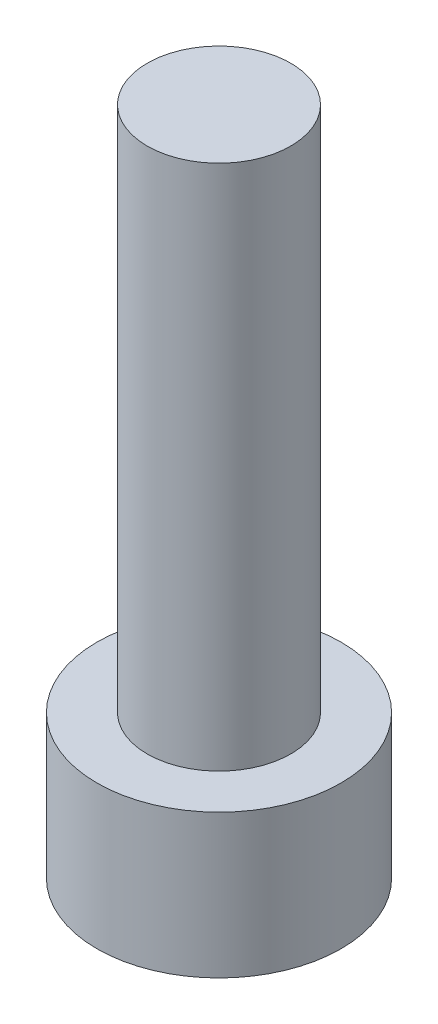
SolidWorks part; units mm, degrees
ref_plane "前视基准面" through (0, 0, 0) normal (0, 0, 1) x (1, 0, 0)
ref_plane "上视基准面" through (0, 0, 0) normal (0, 1, 0) x (1, 0, 0)
ref_plane "右视基准面" through (0, 0, 0) normal (1, 0, 0) x (0, 0, -1)
other "Configuration Table"
sketch "草图1" plane through (0, 0, 0) normal (0, 1, 0) x (1, 0, 0)
  circle A0 centre (0, 0) radius 5.1
  dimension "D1" = 10.2
extrude "凸台-拉伸1" add sketch "草图1" along normal blind 6
sketch "草图2" plane through (0, 6, 0) normal (0, 1, 0) x (1, 0, 0)
  circle A0 centre (0, 0) radius 3
  dimension "D1" = 6
extrude "凸台-拉伸2" add sketch "草图2" along normal blind 22
sketch "草图3" plane through (0, 0, 0) normal (0, -1, 0) x (1, 0, 0)
  line L1 (2.3571, -1.6665) -> (2.6218, 1.2081)
  line L2 (2.6218, 1.2081) -> (0.2647, 2.8746)
  line L3 (0.2647, 2.8746) -> (-2.3571, 1.6665)
  line L4 (-2.3571, 1.6665) -> (-2.6218, -1.2081)
  line L5 (-2.6218, -1.2081) -> (-0.2647, -2.8746)
  line L6 (-0.2647, -2.8746) -> (2.3571, -1.6665)
  circle A0 centre (0, 0) radius 2.5 construction
  dimension "D1" = 5
extrude "切除-拉伸1" cut sketch "草图3" against normal blind 3
